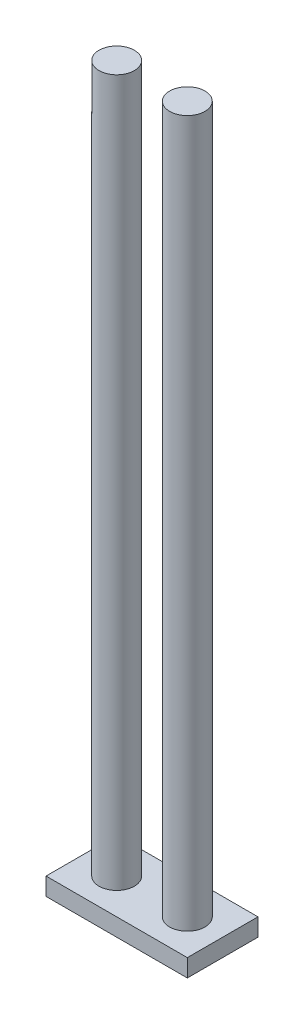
SolidWorks part; units mm, degrees
ref_plane "Front Plane" through (0, 0, 0) normal (0, 0, 1) x (1, 0, 0)
ref_plane "Top Plane" through (0, 0, 0) normal (0, 1, 0) x (1, 0, 0)
ref_plane "Right Plane" through (0, 0, 0) normal (1, 0, 0) x (0, 0, -1)
sketch "Sketch1" plane through (0, 0, 0) normal (0, 1, 0) x (1, 0, 0)
  circle A0 centre (0, 0) radius 5
  circle A1 centre (-20, 0) radius 5
  point P5 (0, 0)
  dimension "D1" = 10
  dimension "D2" = 10
extrude "Boss-Extrude1" add sketch "Sketch1" along normal blind 200
sketch "Sketch2" plane through (0, 0, 0) normal (0, 1, 0) x (1, 0, 0)
  line L1 (-30, -10) -> (10, -10)
  line L2 (-30, -10) -> (-30, 10)
  line L3 (-30, 10) -> (10, 10)
  line L4 (10, -10) -> (10, 10)
  line L5 (-30, -10) -> (10, 10) construction
  line L6 (-30, 10) -> (10, -10) construction
  circle A1 centre (0, 0) radius 5 construction
  circle A2 centre (-20, 0) radius 5 construction
  point P0 (-10, 0)
  dimension "D4" = 5
  dimension "D1" = 5
  dimension "D2" = 5
  dimension "D3" = 5
extrude "Boss-Extrude2" add sketch "Sketch2" against normal blind 5
